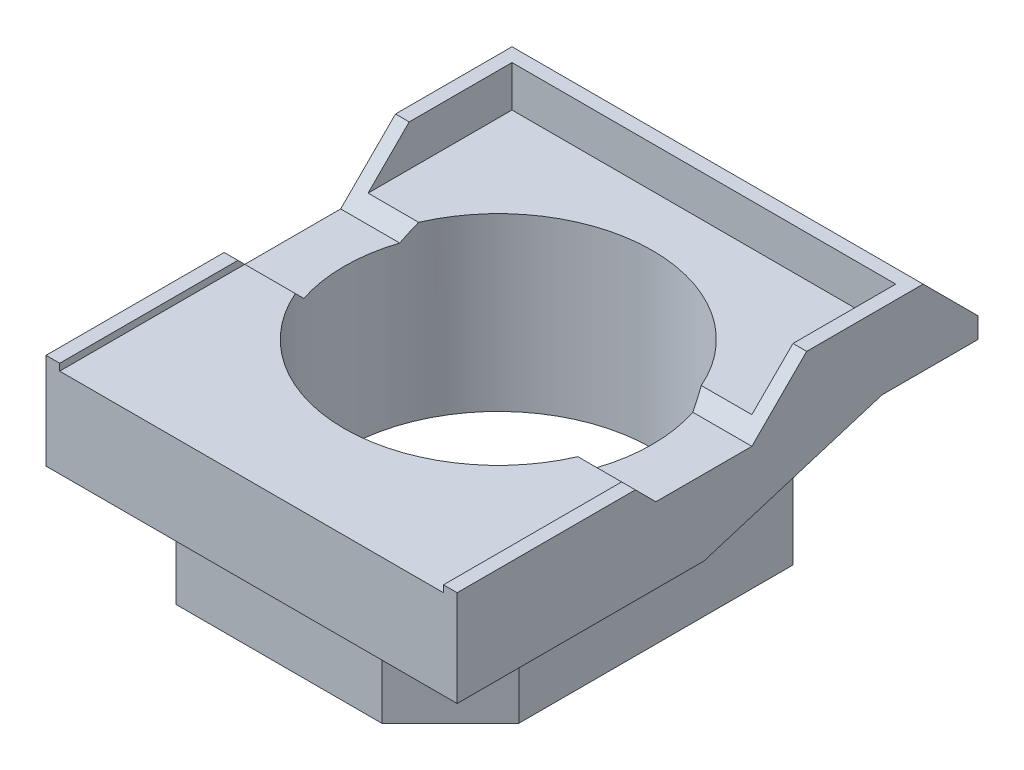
SolidWorks part; units mm, degrees
ref_plane "Plan1" through (0, 0, 0) normal (0, 0, 1) x (1, 0, 0)
ref_plane "Plan2" through (0, 0, 0) normal (0, 1, 0) x (1, 0, 0)
ref_plane "Plan3" through (0, 0, 0) normal (1, 0, 0) x (0, 0, -1)
sketch "Esquisse2" plane through (0, 0, 0) normal (1, 0, 0) x (0, 0, -1)
  line L0 (-18, 7) -> (-18, -6)
  line L1 (-18, -6) -> (12, -6)
  line L2 (12, -6) -> (12, 0)
  line L3 (12, 0) -> (14, 2)
  line L4 (14, 2) -> (20, 2)
  line L5 (20, 2) -> (20, 5.5)
  line L6 (20, 5.5) -> (16, 9.5)
  line L7 (16, 9.5) -> (7.5, 9.5)
  line L8 (7.5, 9.5) -> (3.5, 5.5)
  line L9 (3.5, 5.5) -> (-3.5, 5.5)
  line L10 (-3.5, 5.5) -> (-5, 7)
  line L11 (-5, 7) -> (-18, 7)
  line L12 (0, 39.4398) -> (0, -39.4398) construction
  dimension "D1" = 6
  dimension "D2" = 3.5
  dimension "D3" = 8
  dimension "D4" = 45
  dimension "D5" = 6
  dimension "D6" = 4
  dimension "D7" = 45
  dimension "D8" = 7
  dimension "D9" = 1.5
  dimension "D10" = 4
  dimension "D11" = 7
  dimension "D12" = 45
  dimension "D13" = 18
  dimension "D14" = 45
  dimension "D15" = 12
  dimension "D16" = 20
extrude "Base-Extrusion" add sketch "Esquisse2" along normal mid plane 30
sketch "Esquisse3" plane through (0, -6, 0) normal (0, -1, 0) x (1, 0, 0)
  line L0 (12.5, -9) -> (12.5, 16)
  line L1 (12.5, 16) -> (-12.5, 16)
  line L2 (-12.5, 16) -> (-12.5, -9)
  line L3 (-12.5, -9) -> (-7.9373, -9)
  line L4 (12.5, -9) -> (7.9373, -9)
  line L5 (0, 4.1061) -> (0, -4.1061) construction
  line L6 (15, 18) -> (15, -12) construction
  line L7 (15, -20) -> (-15, -20) construction
  line L8 (15, 18) -> (-15, 18)
  line L9 (15, 18) -> (15, -20)
  line L10 (15, -20) -> (-15, -20)
  line L11 (-15, 18) -> (-15, -20)
  line L12 (-15, 18) -> (-15, -12) construction
  line L13 (15, 18) -> (-15, 18) construction
  arc A0 (7.9373, -9) -> (-7.9373, -9) centre (0, 0) cw
  dimension "D1" = 12
  dimension "D2" = 2.5
  dimension "D3" = 16
  dimension "D4" = 25
extrude "Enlèv. mat.-Extru.1" cut sketch "Esquisse3" against normal blind 6
sketch "Esquisse4" plane through (15, 0, 0) normal (1, 0, 0) x (0, 0, -1)
  line L0 (0, 0) -> (13, 4)
  line L1 (13, 4) -> (20, 4)
  line L2 (20, 0) -> (0, 0)
  line L3 (20, 2) -> (20, 5.5) construction
  line L4 (20, 4) -> (20, 0)
  dimension "D1" = 4
  dimension "D2" = 13
extrude "Enlèv. mat.-Extru.2" cut sketch "Esquisse4" against normal blind 2.5
mirror "Symétrie4" about plane through (0, 0, 0) normal (1, 0, 0)
sketch "Esquisse5" plane through (0, 0, 0) normal (0, -1, 0) x (1, 0, 0)
  line L0 (7.9373, -9) -> (12.5, -9)
  line L1 (12.5, -9) -> (12.5, -20)
  line L2 (12.5, -20) -> (-12.5, -20)
  line L3 (-12.5, -20) -> (-12.5, -9)
  line L4 (-12.5, -9) -> (-7.9373, -9)
  line L5 (7.9373, -9) -> (12.5, -9) construction
  line L6 (12.5, -9) -> (12.5, -12) construction
  line L7 (-12.5, -9) -> (-12.5, -12) construction
  line L9 (12.5, -20) -> (-12.5, -20) construction
  arc A0 (-7.9373, -9) -> (7.9373, -9) centre (0, 0) ccw
  arc A1 (-7.9373, -9) -> (7.9373, -9) centre (0, 0) ccw construction
extrude "Enlèv. mat.-Extru.3" cut sketch "Esquisse5" against normal up to surface (4 mm away)
sketch "Esquisse6" plane through (0, 9.5, 0) normal (0, 1, 0) x (-1, 0, 0)
  line L0 (-15, 18) -> (15, 18) construction
  line L1 (14, 18) -> (-14, 18)
  line L2 (14, 18) -> (14, -15)
  line L3 (14, -15) -> (-14, -15)
  line L4 (-14, 18) -> (-14, -15)
  line L5 (0, 7.5) -> (0, -7.5) construction
  line L6 (-15, -7.5) -> (15, -7.5) construction
  line L7 (15, 5) -> (15, 18) construction
  line L8 (-15, -16) -> (15, -16) construction
  dimension "D1" = 1
  dimension "D2" = 1
extrude "Enlèv. mat.-Extru.4" cut sketch "Esquisse6" against normal blind 3
sketch "Esquisse7" plane through (0, -6, 0) normal (0, -1, 0) x (1, 0, 0)
  circle A0 centre (0, 0) radius 11.25
  dimension "D1" = 22.5
extrude "Enlèv. mat.-Extru.5" cut sketch "Esquisse7" against normal through all
chamfer "Chanfrein1" distance 5 angle 45
